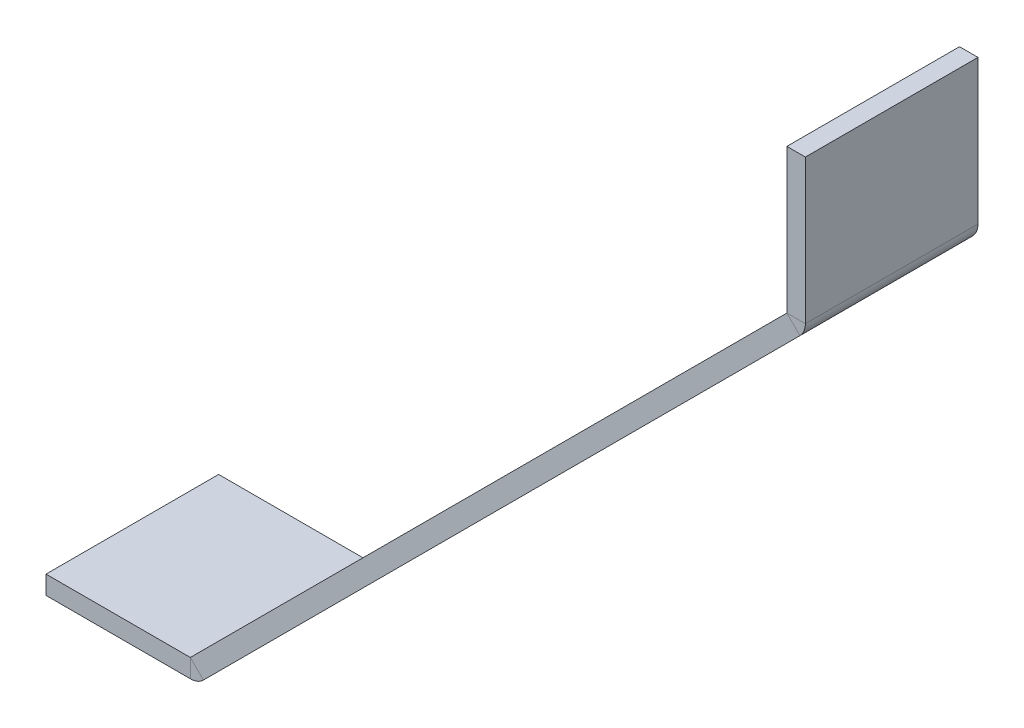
SolidWorks part; units mm, degrees
ref_plane "Front" through (0, 0, 0) normal (0, 0, 1) x (1, 0, 0)
ref_plane "Top" through (0, 0, 0) normal (0, 1, 0) x (1, 0, 0)
ref_plane "Right" through (0, 0, 0) normal (1, 0, 0) x (0, 0, -1)
sketch "Sketch1" plane through (0, 0, 0) normal (0, 1, 0) x (1, 0, 0)
  line L1 (0, 0) -> (93, 0)
  line L2 (0, 0) -> (0, 14)
  line L3 (0, 14) -> (93, 14)
  line L4 (93, 0) -> (93, 14)
  circle A0 centre (59, 7) radius 1.75
  circle A1 centre (34, 7) radius 1.75
sheet metal parameters "Sheet-Metal1" thickness 1.5 parameters "D1"=3
base flange "Base-Flange1" sketch "Sketch1" thickness 1.5 reverse thickness direction yes parameters "D1"=3
hole_wizard "CSK for M3 Countersunk Flat Head Screw1" positions "3DSketch2" profile "Sketch4" countersink size "M3" standard "ISO"
sketch3d "3DSketch2"
  point P0 (34, 0, -7)
  point P2 (59, 0, -7)
sketch "Sketch4" plane through (34, 0, -7) normal (1, 0, 0) x (0, 0, -1)
  line L0 (0, 0) -> (0, 1.5)
  line L1 (0, 1.5) -> (1.75, 1.5)
  line L2 (1.75, 1.5) -> (1.75, 1.4)
  line L3 (1.75, 1.4) -> (3.15, 0)
  line L5 (3.15, 0) -> (0, 0)
  line L6 (-1.75, 1.4) -> (-3.15, 0) construction
  line L11 (0, -6.35) -> (0, 107.95) construction
  dimension "Thru Hole Dia." = 3.5
  dimension "Thru Hole Depth" = 1.5
  dimension "Near C'Sink Dia." = 6.3
  dimension "Near C'Sink Angle" = 90
sketch "Sketch5" plane through (0, 1.5, 0) normal (0, 1, 0) x (-1, 0, 0)
  line L2 (-12, -14) -> (-12, 0)
  line L3 (-81, -14) -> (-81, 0)
sketched bend "Sketched Bend1" parameters "D1"=0
bend "SketchBend1" bend radius 0 bend angle 45 parameters "D5"=1
bend "SketchBend2" bend radius 0 bend angle 45 parameters "D5"=2
flat pattern "Flat-Pattern1"
sketch "Bend-Lines1" plane through (0, 1, 0) normal (0, 1, 0) x (-1, 0, 0)
  line L0 (-81, -14) -> (-81, 0) construction
  line L1 (-12, -14) -> (-12, 0) construction
bend of the flat pattern "Flatten-<SketchBend1>1"
bend of the flat pattern "Flatten-<SketchBend2>1"
